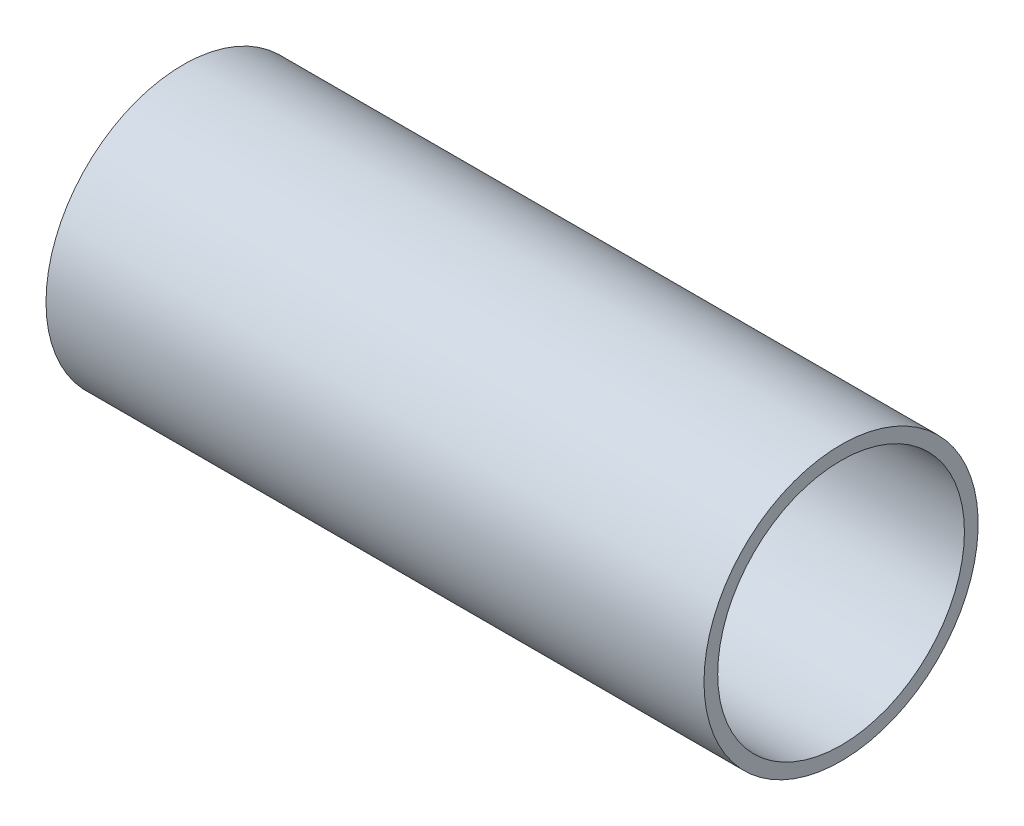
SolidWorks part; units mm, degrees
ref_plane "Front" through (0, 0, 0) normal (0, 0, 1) x (1, 0, 0)
ref_plane "Top" through (0, 0, 0) normal (0, 1, 0) x (1, 0, 0)
ref_plane "Right" through (0, 0, 0) normal (1, 0, 0) x (0, 0, -1)
sketch "Sketch1" plane through (0, 0, 0) normal (1, 0, 0) x (0, 0, -1)
  circle A0 centre (0, 0) radius 14.2875
  circle A1 centre (0, 0) radius 15.875
  dimension "D1" = 28.575
  dimension "D2" = 31.75
extrude "Base-Extrude" add sketch "Sketch1" along normal blind 76.2
